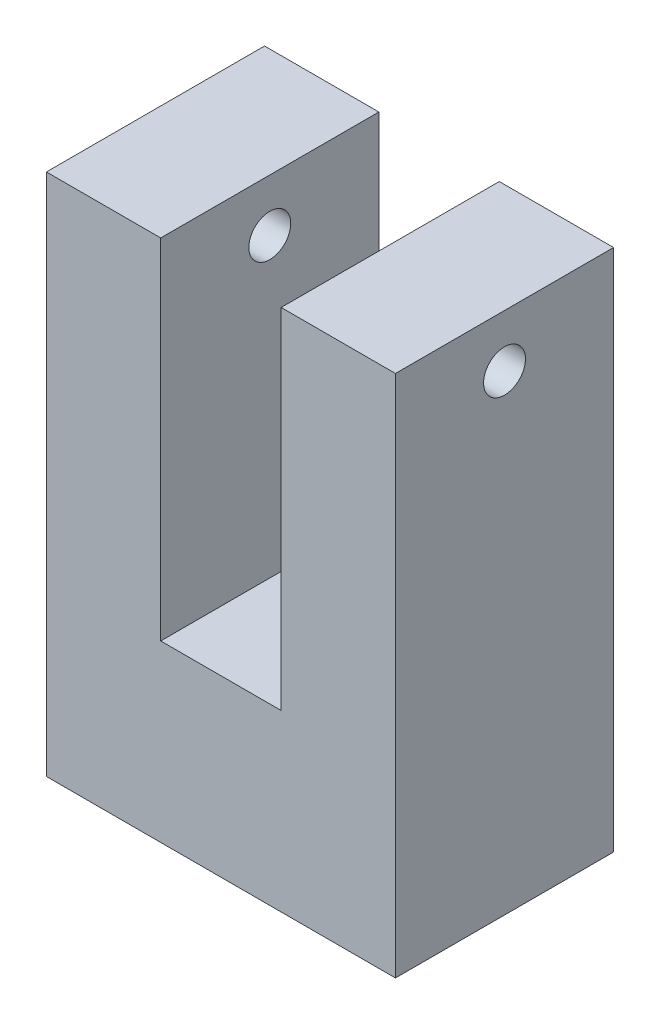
SolidWorks part; units mm, degrees
ref_plane "Front Plane" through (0, 0, 0) normal (0, 0, 1) x (1, 0, 0)
ref_plane "Top Plane" through (0, 0, 0) normal (0, 1, 0) x (1, 0, 0)
ref_plane "Right Plane" through (0, 0, 0) normal (1, 0, 0) x (0, 0, -1)
sketch "Sketch1" plane through (0, 0, 0) normal (0, 1, 0) x (1, 0, 0)
  line L1 (-12.7, -7.9375) -> (12.7, -7.9375)
  line L2 (-12.7, -7.9375) -> (-12.7, 7.9375)
  line L3 (-12.7, 7.9375) -> (12.7, 7.9375)
  line L4 (12.7, -7.9375) -> (12.7, 7.9375)
  line L5 (-12.7, -7.9375) -> (12.7, 7.9375) construction
  line L6 (-12.7, 7.9375) -> (12.7, -7.9375) construction
  point P0 (0, 0)
  dimension "D1" = 15.875
  dimension "D2" = 25.4
extrude "Boss-Extrude1" add sketch "Sketch1" along normal blind 38.1
sketch "Sketch2" plane through (0, 0, 7.9375) normal (0, 0, 1) x (1, 0, 0)
  line L0 (0, 38.1) -> (0, 0) construction
  line L1 (-12.7, 38.1) -> (12.7, 38.1) construction
  line L2 (-12.7, 0) -> (12.7, 0) construction
  line L4 (-4.3815, 12.7) -> (4.3815, 12.7)
  line L5 (-4.3815, 12.7) -> (-4.3815, 38.1)
  line L6 (-4.3815, 38.1) -> (4.3815, 38.1)
  line L7 (4.3815, 12.7) -> (4.3815, 38.1)
  line L8 (-4.3815, 12.7) -> (4.3815, 38.1) construction
  line L9 (-4.3815, 38.1) -> (4.3815, 12.7) construction
  point P6 (0, 25.4)
  dimension "D1" = 8.763
  dimension "D2" = 25.4
extrude "Cut-Extrude1" cut sketch "Sketch2" against normal through all
sketch "Sketch3" plane through (12.7, 0, 0) normal (1, 0, 0) x (0, 0, -1)
  line L0 (0, 38.1) -> (0, 0) construction
  line L1 (-7.9375, 38.1) -> (7.9375, 38.1) construction
  line L2 (-7.9375, 0) -> (7.9375, 0) construction
  circle A0 centre (0, 34.29) radius 1.524
  dimension "D1" = 34.29
  dimension "D2" = 3.048
extrude "Cut-Extrude2" cut sketch "Sketch3" against normal through all
sketch "Sketch4" plane through (0, 0, 0) normal (0, -1, 0) x (1, 0, 0)
  circle A0 centre (0, 0) radius 2.0955
  dimension "D1" = 4.191
extrude "Cut-Extrude3" cut sketch "Sketch4" against normal through all
